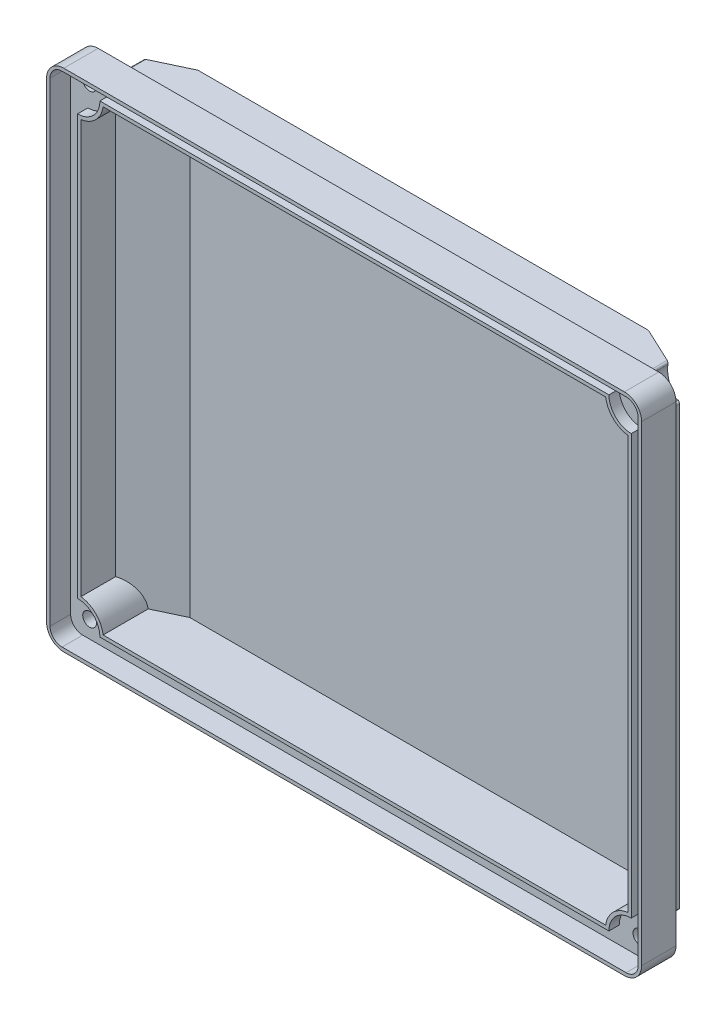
SolidWorks part; units mm, degrees
ref_plane "前视基准面" through (0, 0, 0) normal (0, 0, 1) x (1, 0, 0)
ref_plane "上视基准面" through (0, 0, 0) normal (0, 1, 0) x (1, 0, 0)
ref_plane "右视基准面" through (0, 0, 0) normal (1, 0, 0) x (0, 0, -1)
sketch "草图1" plane through (0, 0, 0) normal (0, 0, 1) x (1, 0, 0)
  line L0 (-80.5, 67.5) -> (80.5, 67.5)
  line L1 (-86.5, -73.5) -> (86.5, -73.5)
  line L2 (-86.5, -73.5) -> (-86.5, 73.5)
  line L3 (-86.5, 73.5) -> (86.5, 73.5)
  line L4 (86.5, -73.5) -> (86.5, 73.5)
  line L5 (-86.5, -73.5) -> (86.5, 73.5) construction
  line L6 (-86.5, 73.5) -> (86.5, -73.5) construction
  line L7 (80.5, -67.5) -> (80.5, 67.5)
  line L8 (-80.5, -67.5) -> (80.5, -67.5)
  line L9 (-80.5, -67.5) -> (-80.5, 67.5)
  point P0 (0, 0)
  dimension "D1" = 173
  dimension "D2" = 147
  dimension "D3" = 6
extrude "凸台-拉伸1" add sketch "草图1" along normal blind 10
sketch "草图2" plane through (0, 0, 10) normal (0, 0, 1) x (1, 0, 0)
  line L0 (85.5, 72.5) -> (-85.5, 72.5)
  line L1 (-85.5, 72.5) -> (-85.5, -72.5)
  line L2 (-85.5, -72.5) -> (85.5, -72.5)
  line L3 (85.5, -72.5) -> (85.5, 72.5)
extrude "切除-拉伸1" cut sketch "草图2" against normal blind 6
sketch "草图4" plane through (0, 0, 4) normal (0, 0, 1) x (1, 0, 0)
  line L0 (-74, 67.5) -> (74, 67.5)
  line L1 (80.5, 61) -> (80.5, -61)
  line L2 (74, -67.5) -> (-74, -67.5)
  line L3 (-80.5, -61) -> (-80.5, 61)
  line L4 (-79.5, -60.067) -> (-79.5, 60.067)
  line L5 (-73.067, 66.5) -> (73.067, 66.5)
  line L6 (79.5, 60.067) -> (79.5, -60.067)
  line L7 (73.067, -66.5) -> (-73.067, -66.5)
  line L8 (-79.5, -66.5) -> (-79.5, 66.5) construction
  line L9 (-79.5, 66.5) -> (79.5, 66.5) construction
  line L10 (-74, 67.5) -> (-70.5, 67.5) construction
  line L13 (0, 66.5) -> (0, 67.5) construction
  line L16 (79.5, 66.5) -> (79.5, -66.5) construction
  line L17 (0, 0) -> (0, 103.398) construction
  line L22 (79.5, -66.5) -> (-79.5, -66.5) construction
  line L23 (-80.5, -67.5) -> (-80.5, 67.5) construction
  line L24 (-80.5, 67.5) -> (80.5, 67.5) construction
  line L25 (0, 0) -> (110.3471, 0) construction
  line L26 (80.5, -67.5) -> (-80.5, -67.5) construction
  line L27 (80.5, 67.5) -> (80.5, -67.5) construction
  arc A5 (-80.5, 61) -> (-74, 67.5) centre (-80.5, 67.5) ccw
  arc A6 (-79.5, 60.067) -> (-73.067, 66.5) centre (-80.5, 67.5) ccw
  arc A7 (-80.5, 60) -> (-73, 67.5) centre (-80.5, 67.5) ccw construction
  arc A8 (79.5, 60.067) -> (73.067, 66.5) centre (80.5, 67.5) cw
  arc A9 (80.5, 61) -> (74, 67.5) centre (80.5, 67.5) cw
  arc A10 (80.5, -61) -> (74, -67.5) centre (80.5, -67.5) ccw
  arc A11 (79.5, -60.067) -> (73.067, -66.5) centre (80.5, -67.5) ccw
  arc A12 (-79.5, -60.067) -> (-73.067, -66.5) centre (-80.5, -67.5) cw
  arc A13 (-80.5, -61) -> (-74, -67.5) centre (-80.5, -67.5) cw
  dimension "D2" = 1
  dimension "D1" = 1
extrude "凸台-拉伸2" add sketch "草图4" along normal blind 3 and the other way up to surface
fillet "圆角1" radius 3.5 4 edges at (-85.5, -72.5, 7) (85.5, -72.5, 7) (85.5, 72.5, 7) (-85.5, 72.5, 7)
fillet "圆角2" radius 5 4 edges at (86.5, 73.5, 5) (86.5, -73.5, 5) (-86.5, -73.5, 5) (-86.5, 73.5, 5)
sketch "草图6" plane through (0, 0, 4) normal (0, 0, 1) x (1, 0, 0)
  line L0 (0, 0) -> (80, 0) construction
  line L1 (80, 0) -> (80, 67.5) construction
  circle A0 centre (80, 67.5) radius 2
  circle A1 centre (-80, 67.5) radius 2
  circle A2 centre (-80, -67.5) radius 2
  circle A3 centre (80, -67.5) radius 2
  dimension "D1" = 2
  dimension "D2" = 2
extrude "切除-拉伸3" cut sketch "草图6" against normal blind 10
sketch "草图7" plane through (0, 0, 4) normal (0, 0, 1) x (1, 0, 0)
  line L0 (-74, 67.5) -> (-78, 67.5)
  line L1 (-80.5, 61) -> (-80.5, 65.5635)
  line L2 (0, 0) -> (0, 92.1475) construction
  line L3 (0, 0) -> (115.0146, 0) construction
  line L4 (80.5, 61) -> (80.5, 65.5635)
  line L5 (74, 67.5) -> (78, 67.5)
  line L6 (-80.5, -61) -> (-80.5, -65.5635)
  line L7 (-74, -67.5) -> (-78, -67.5)
  line L8 (80.5, -61) -> (80.5, -65.5635)
  line L9 (74, -67.5) -> (78, -67.5)
  arc A0 (-74, 67.5) -> (-80.5, 61) centre (-80.5, 67.5) cw
  arc A1 (-80.5, 65.5635) -> (-78, 67.5) centre (-80, 67.5) ccw
  arc A2 (74, 67.5) -> (80.5, 61) centre (80.5, 67.5) ccw
  arc A3 (80.5, 65.5635) -> (78, 67.5) centre (80, 67.5) cw
  arc A4 (-74, -67.5) -> (-80.5, -61) centre (-80.5, -67.5) ccw
  arc A5 (-80.5, -65.5635) -> (-78, -67.5) centre (-80, -67.5) cw
  arc A6 (74, -67.5) -> (80.5, -61) centre (80.5, -67.5) cw
  arc A7 (80.5, -65.5635) -> (78, -67.5) centre (80, -67.5) ccw
extrude "凸台-拉伸3" add sketch "草图7" against normal up to surface (4 mm away)
sketch "草图8" plane through (0, 0, 0) normal (0, 0, -1) x (-1, 0, 0)
  line L8 (81.5, 69.5) -> (-81.5, 69.5)
  line L9 (-82.5, 68.5) -> (-82.5, -68.5)
  line L10 (-81.5, -69.5) -> (81.5, -69.5)
  line L11 (82.5, -68.5) -> (82.5, 68.5)
  line L12 (75.7574, 69.5) -> (-75.7574, 69.5)
  line L13 (-82.5, 63.4689) -> (-82.5, -63.4689)
  line L14 (-75.7574, -69.5) -> (75.7574, -69.5)
  line L15 (82.5, -63.4689) -> (82.5, 63.4689)
  arc A4 (-81.7778, 63.9168) -> (-76.2288, 68.8333) centre (-80, 67.5) ccw
  arc A5 (76.2288, 68.8333) -> (81.7778, 63.9168) centre (80, 67.5) ccw
  arc A6 (81.7778, -63.9168) -> (76.2288, -68.8333) centre (80, -67.5) ccw
  arc A7 (-76.2288, -68.8333) -> (-81.7778, -63.9168) centre (-80, -67.5) ccw
  arc A8 (-81.5, 69.5) -> (-82.5, 68.5) centre (-81.5, 68.5) ccw
  arc A9 (-82.5, -68.5) -> (-81.5, -69.5) centre (-81.5, -68.5) ccw
  arc A10 (81.5, -69.5) -> (82.5, -68.5) centre (81.5, -68.5) ccw
  arc A11 (82.5, 68.5) -> (81.5, 69.5) centre (81.5, 68.5) ccw
  arc A16 (75.7574, -69.5) -> (76.2288, -68.8333) centre (75.7574, -69) ccw
  arc A17 (82.5, -63.4689) -> (81.7778, -63.9168) centre (82, -63.4689) cw
  arc A18 (82.5, 63.4689) -> (81.7778, 63.9168) centre (82, 63.4689) ccw
  arc A19 (76.2288, 68.8333) -> (75.7574, 69.5) centre (75.7574, 69) ccw
  arc A20 (-82.5, 63.4689) -> (-81.7778, 63.9168) centre (-82, 63.4689) cw
  arc A21 (-75.7574, 69.5) -> (-76.2288, 68.8333) centre (-75.7574, 69) ccw
  arc A22 (-75.7574, -69.5) -> (-76.2288, -68.8333) centre (-75.7574, -69) cw
  arc A23 (-81.7778, -63.9168) -> (-82.5, -63.4689) centre (-82, -63.4689) cw
  dimension "D2" = 0.5
  dimension "D1" = 4
extrude "凸台-拉伸4" add sketch "草图8" along normal blind 13
sketch "草图9" plane through (0, -69.5, 0) normal (0, -1, 0) x (1, 0, 0)
  line L0 (-82.5, -13) -> (-65.5, -13) construction
  line L1 (75.7574, -13) -> (-75.7574, -13) construction
  line L2 (0, 0) -> (0, -16.0779) construction
  line L3 (-82.5, -5) -> (-86.2647, -5) construction
  line L4 (-82.5, -5) -> (-65.5, -13)
  line L5 (-82.5, -13) -> (-82.5, 0) construction
  line L6 (-65.5, -13) -> (-86.2647, -13)
  line L7 (-86.2647, -13) -> (-86.2647, -5)
  line L8 (-82.5, -5) -> (-86.2647, -5)
  line L9 (82.5, -5) -> (86.2647, -5)
  line L10 (86.2647, -13) -> (86.2647, -5)
  line L11 (65.5, -13) -> (86.2647, -13)
  line L12 (82.5, -5) -> (65.5, -13)
extrude "切除-拉伸4" cut sketch "草图9" against normal through all
fillet "圆角3" radius 1 2 edges at (65.5, 0, -13) (-65.5, 0, -13)
shell "抽壳1" thickness 3
sketch "草图10" plane through (0, 0, 7) normal (0, 0, 1) x (1, 0, 0)
  line L0 (-79.5, 60.067) -> (-80.5, 61)
  line L1 (-73.067, 66.5) -> (-74, 67.5)
  line L2 (0, 0) -> (0, 94.1711) construction
  line L3 (79.5, 60.067) -> (80.5, 61)
  line L4 (73.067, 66.5) -> (74, 67.5)
  line L5 (0, 0) -> (100.2263, 0) construction
  line L6 (79.5, -60.067) -> (80.5, -61)
  line L7 (73.067, -66.5) -> (74, -67.5)
  line L8 (-79.5, -60.067) -> (-80.5, -61)
  line L9 (-73.067, -66.5) -> (-74, -67.5)
  arc A0 (-74, 67.5) -> (-80.5, 61) centre (-80.5, 67.5) cw
  arc A1 (-73.067, 66.5) -> (-79.5, 60.067) centre (-80.5, 67.5) cw
  arc A2 (73.067, 66.5) -> (79.5, 60.067) centre (80.5, 67.5) ccw
  arc A3 (74, 67.5) -> (80.5, 61) centre (80.5, 67.5) ccw
  arc A4 (74, -67.5) -> (80.5, -61) centre (80.5, -67.5) cw
  arc A5 (73.067, -66.5) -> (79.5, -60.067) centre (80.5, -67.5) cw
  arc A6 (-73.067, -66.5) -> (-79.5, -60.067) centre (-80.5, -67.5) ccw
  arc A7 (-74, -67.5) -> (-80.5, -61) centre (-80.5, -67.5) ccw
extrude "凸台-拉伸5" add sketch "草图10" against normal up to body separate body
